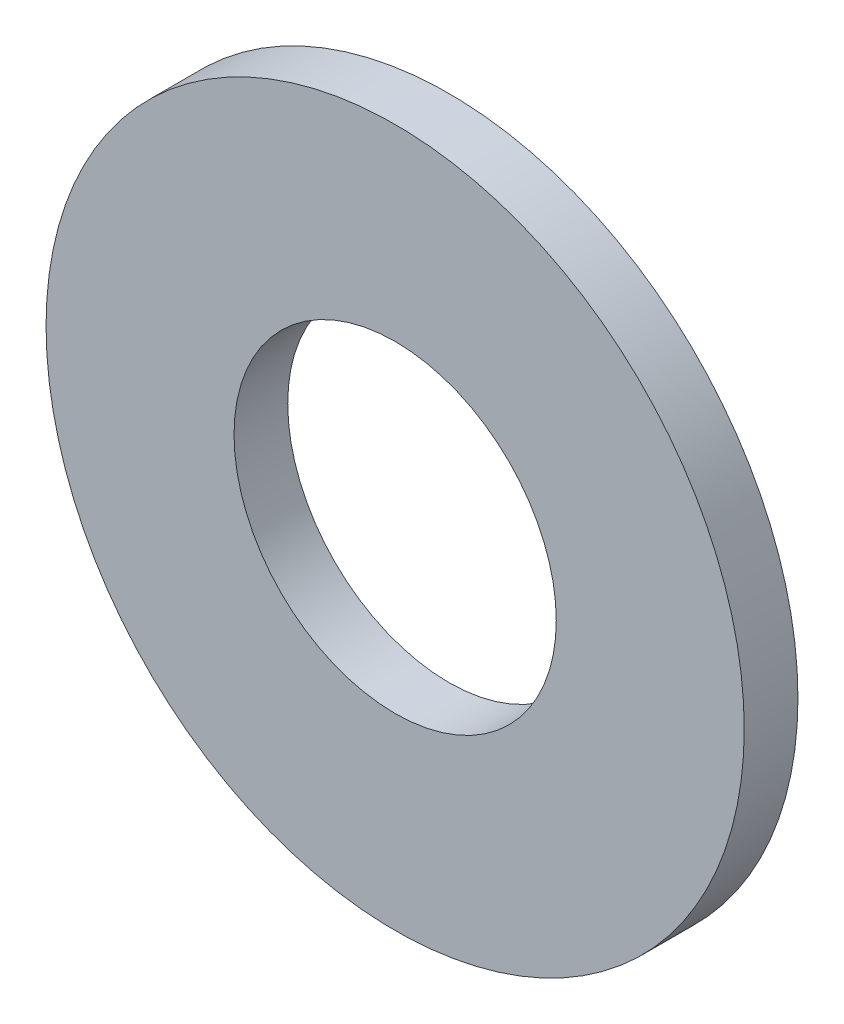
SolidWorks part; units mm, degrees
ref_plane "Plan de face" through (0, 0, 0) normal (0, 0, 1) x (1, 0, 0)
ref_plane "Plan de dessus" through (0, 0, 0) normal (0, 1, 0) x (1, 0, 0)
ref_plane "Plan de droite" through (0, 0, 0) normal (1, 0, 0) x (0, 0, -1)
sketch "Esquisse1" plane through (0, 0, 0) normal (0, 0, 1) x (1, 0, 0)
  circle A0 centre (0, 0) radius 1.5
  circle A1 centre (0, 0) radius 3.25
extrude "Extrusion1" add sketch "Esquisse1" along normal blind 0.5
